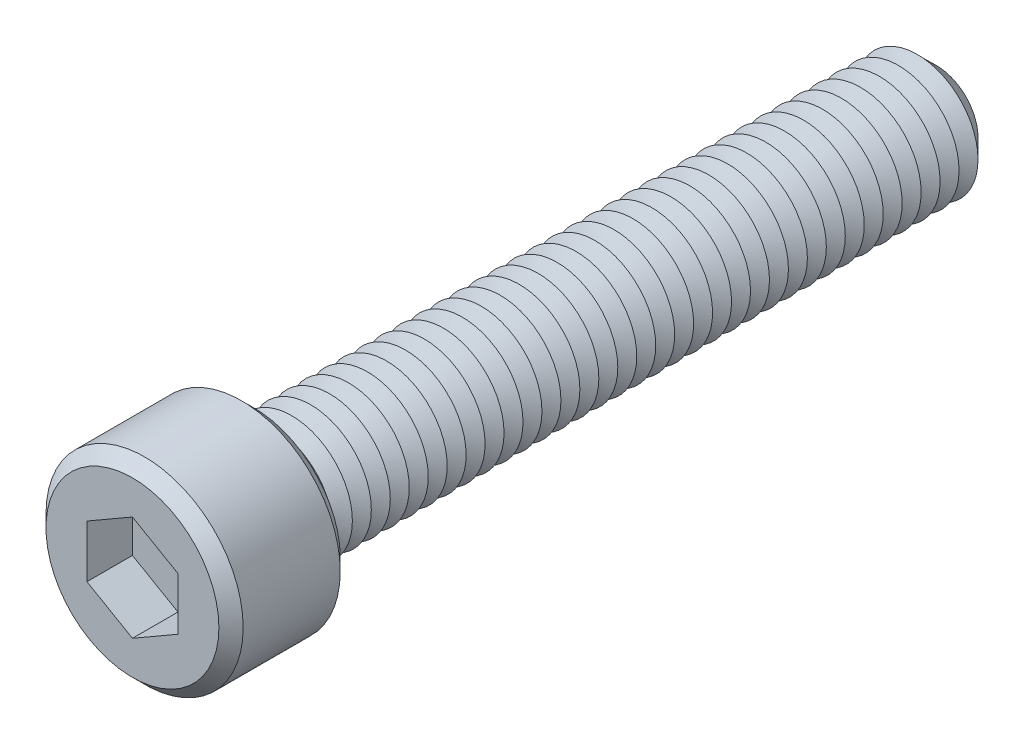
SolidWorks part; units mm, degrees
ref_plane "Front Plane" through (0, 0, 0) normal (0, 0, 1) x (1, 0, 0)
ref_plane "Top Plane" through (0, 0, 0) normal (0, 1, 0) x (1, 0, 0)
ref_plane "Right Plane" through (0, 0, 0) normal (1, 0, 0) x (0, 0, -1)
sketch "Sketch1" plane through (0, 0, 0) normal (0, 0, 1) x (1, 0, 0)
  circle A0 centre (0, 0) radius 6.5
  dimension "D1" = 13
extrude "Boss-Extrude1" add sketch "Sketch1" along normal blind 8
sketch "Sketch2" plane through (0, 0, 0) normal (0, 0, -1) x (-1, 0, 0)
  circle A0 centre (0, 0) radius 4
  dimension "D1" = 8
extrude "Boss-Extrude2" add sketch "Sketch2" along normal blind 45
chamfer "Chamfer1" distance 1.25 angle 45 1 edges at (-4, 0, -45)
sketch "Sketch3" plane through (0, 0, 0) normal (1, 0, 0) x (0, 0, -1)
  line L0 (-2.5121, 0) -> (4.5776, 0) construction
sketch "Sketch4" plane through (0, 0, 0) normal (1, 0, 0) x (0, 0, -1)
  line L0 (0, 4) -> (0.625, 2.9175)
  line L1 (0.625, 2.9175) -> (1.25, 4)
  line L2 (43.75, 4) -> (0, 4) construction
  line L3 (1.25, 4) -> (0, 4)
  dimension "D1" = 1.25
revolve "Cut-Revolve1" cut sketch "Sketch4" angle 360 about L0
pattern_linear "LPattern1" count 35 spacing 1.25 along (0, 0, -1) of "Cut-Revolve1"
sketch "Sketch5" plane through (0, 0, 8) normal (0, 0, 1) x (1, 0, 0)
  line L1 (0, 3.4641) -> (-3, 1.7321)
  line L2 (-3, 1.7321) -> (-3, -1.7321)
  line L3 (-3, -1.7321) -> (0, -3.4641)
  line L4 (0, -3.4641) -> (3, -1.7321)
  line L5 (3, -1.7321) -> (3, 1.7321)
  line L6 (3, 1.7321) -> (0, 3.4641)
  circle A0 centre (0, 0) radius 3 construction
  dimension "D1" = 6
extrude "Cut-Extrude1" cut sketch "Sketch5" against normal blind 3
sketch "Sketch6" plane through (0, 0, 5) normal (0, 0, 1) x (1, 0, 0)
  circle A0 centre (0, 0) radius 0.9
  dimension "D1" = 1.8
extrude "Cut-Extrude2" cut sketch "Sketch6" against normal up to surface (50 mm away)
chamfer "Chamfer2" distance 0.8 angle 45 2 edges at (6.5, 0, 0) (6.5, 0, 8)
